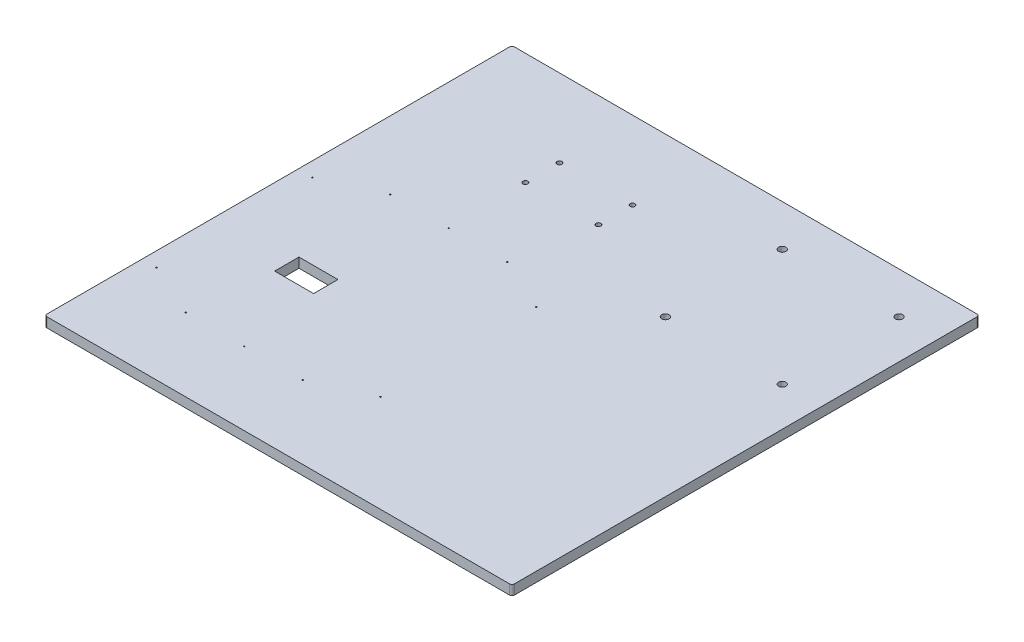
SolidWorks part; units mm, degrees
ref_plane "Front Plane" through (0, 0, 0) normal (0, 0, 1) x (1, 0, 0)
ref_plane "Top Plane" through (0, 0, 0) normal (0, 1, 0) x (1, 0, 0)
ref_plane "Right Plane" through (0, 0, 0) normal (1, 0, 0) x (0, 0, -1)
sketch "Sketch1" plane through (0, 0, 0) normal (0, 1, 0) x (1, 0, 0)
  line L1 (0, 0) -> (609.6, 0)
  line L2 (0, 0) -> (0, 609.6)
  line L3 (0, 609.6) -> (609.6, 609.6)
  line L4 (609.6, 0) -> (609.6, 609.6)
  line L5 (99.9977, 231.775) -> (150.7977, 231.775)
  line L6 (99.9977, 231.775) -> (99.9977, 200.025)
  line L7 (99.9977, 200.025) -> (150.7977, 200.025)
  line L8 (150.7977, 231.775) -> (150.7977, 200.025)
  dimension "D1" = 609.6
  dimension "D2" = 609.6
extrude "Boss-Extrude1" add sketch "Sketch1" along normal blind 12.7
fillet "Fillet7" radius 3.175 4 edges at (609.6, 6.35, -609.6) (609.6, 6.35, 0) (0, 6.35, 0) (0, 6.35, -609.6)
hole_wizard "1/16 (0.0625) Diameter Hole1" positions "Sketch2" profile "Sketch3" hole size "1/16" standard "ANSI Inch"
sketch "Sketch2" plane through (0, 12.7, 0) normal (0, 1, 0) x (1, 0, 0)
  point P95 (88.9, 95.25)
  point P97 (165.1, 95.25)
  point P99 (241.3, 95.25)
  point P101 (311.15, 127)
  point P103 (311.15, 330.2)
  point P105 (241.3, 361.95)
  point P107 (165.1, 361.95)
  point P109 (88.9, 361.95)
  point P111 (19.05, 330.2)
  point P113 (19.05, 127)
  dimension "D3" = 88.9
  dimension "D4" = 76.2
  dimension "D5" = 76.2
  dimension "D11" = 31.75
  dimension "D12" = 69.85
  dimension "D14" = 69.85
  dimension "D15" = 95.25
  dimension "D16" = 203.2
  dimension "D17" = 31.75
sketch "Sketch3" plane through (19.05, 12.7, -127) normal (1, 0, 0) x (0, 0, 1)
  line L0 (0, 0) -> (0, 12.7)
  line L1 (0, 12.7) -> (0.7937, 12.7)
  line L2 (0.7937, 12.7) -> (0.7937, 0)
  line L5 (0.7937, 0) -> (0, 0)
  line L11 (0, -6.35) -> (0, 107.95) construction
  dimension "Thru Hole Dia." = 1.5875
  dimension "Thru Hole Depth" = 12.7
hole_wizard "3/8 (0.375) Diameter Hole1" positions "Sketch4" profile "Sketch5" hole size "3/8" standard "ANSI Inch"
sketch "Sketch4" plane through (0, 12.7, 0) normal (0, 1, 0) x (1, 0, 0)
  point P0 (558.8, 555.625)
  point P2 (558.8, 403.225)
  point P4 (406.4, 403.225)
  point P6 (406.4, 555.625)
  dimension "D1" = 50.8
  dimension "D2" = 152.4
  dimension "D3" = 152.4
  dimension "D7" = 50.8
sketch "Sketch5" plane through (558.8, 12.7, -555.625) normal (1, 0, 0) x (0, 0, 1)
  line L0 (0, 0) -> (0, 12.7)
  line L1 (0, 12.7) -> (4.7625, 12.7)
  line L2 (4.7625, 12.7) -> (4.7625, 0)
  line L5 (4.7625, 0) -> (0, 0)
  line L11 (0, -6.35) -> (0, 107.95) construction
  dimension "Thru Hole Dia." = 9.525
  dimension "Thru Hole Depth" = 12.7
hole_wizard "1/4 (0.25) Diameter Hole1" positions "Sketch6" profile "Sketch7" hole size "1/4" standard "ANSI Inch"
sketch "Sketch6" plane through (0, 12.7, 0) normal (0, 1, 0) x (1, 0, 0)
  line L0 (0, 606.425) -> (0, 3.175) construction
  circle A0 centre (165.1, 361.95) radius 0.7938 construction
  point P0 (258.7625, 463.55)
  point P2 (163.5125, 463.55)
  point P4 (163.5125, 508)
  point P6 (258.7625, 508)
  dimension "D3" = 101.6
  dimension "D1" = 44.45
  dimension "D2" = 95.25
  dimension "D4" = 163.5125
sketch "Sketch7" plane through (258.7625, 12.7, -463.55) normal (1, 0, 0) x (0, 0, 1)
  line L0 (0, 0) -> (0, 12.7)
  line L1 (0, 12.7) -> (3.175, 12.7)
  line L2 (3.175, 12.7) -> (3.175, 0)
  line L5 (3.175, 0) -> (0, 0)
  line L11 (0, -6.35) -> (0, 107.95) construction
  dimension "Thru Hole Dia." = 6.35
  dimension "Thru Hole Depth" = 12.7
